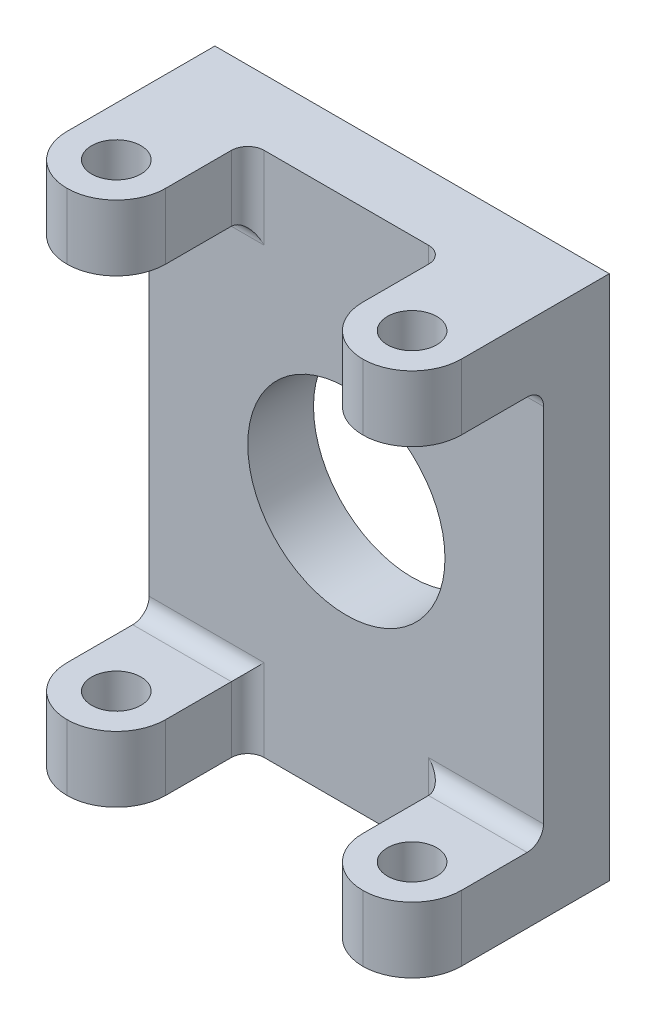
SolidWorks part; units mm, degrees
ref_plane "Front Plane" through (0, 0, 0) normal (0, 0, 1) x (1, 0, 0)
ref_plane "Top Plane" through (0, 0, 0) normal (0, 1, 0) x (1, 0, 0)
ref_plane "Right Plane" through (0, 0, 0) normal (1, 0, 0) x (0, 0, -1)
sketch "Sketch2" plane through (0, 0, 0) normal (0, 0, 1) x (1, 0, 0)
  line L0 (0, 0) -> (137.829, 0) construction
  line L1 (0, 0) -> (0, 93.6852) construction
  line L3 (-76.2, -101.6) -> (76.2, -101.6)
  line L4 (-76.2, -101.6) -> (-76.2, 101.6)
  line L5 (-76.2, 101.6) -> (76.2, 101.6)
  line L6 (76.2, -101.6) -> (76.2, 101.6)
  dimension "D1" = 152.4
  dimension "D2" = 203.2
  dimension "D3" = 76.2
  dimension "D4" = 101.6
extrude "Extrude2" add sketch "Sketch2" along normal blind 25.4
sketch "Sketch3" plane through (0, 0, 25.4) normal (0, 0, 1) x (1, 0, 0)
  line L1 (-76.2, -101.6) -> (-38.1, -101.6)
  line L2 (-76.2, -101.6) -> (-76.2, -76.2)
  line L3 (-76.2, -76.2) -> (-38.1, -76.2)
  line L4 (-38.1, -101.6) -> (-38.1, -76.2)
  dimension "D1" = 38.1
  dimension "D2" = 25.4
extrude "Extrude3" add sketch "Sketch3" along normal blind 50.8
fillet "Fillet1" radius 19.05 2 edges at (-38.1, -88.9, 76.2) (-76.2, -88.9, 76.2)
sketch "Sketch4" plane through (0, -101.6, 0) normal (0, -1, 0) x (1, 0, 0)
  circle A0 centre (-57.15, 57.15) radius 9.525
  arc A1 (-57.15, 76.2) -> (-76.2, 57.15) centre (-57.15, 57.15) ccw construction
  dimension "D1" = 19.05
extrude "Cut-Extrude1" cut sketch "Sketch4" against normal through all
mirror "Mirror1" about plane through (0, 0, 0) normal (1, 0, 0) of "Cut-Extrude1", "Fillet1", "Extrude3"
mirror "Mirror2" about plane through (0, 0, 0) normal (0, 1, 0) of "Mirror1", "Cut-Extrude1", "Fillet1", "Extrude3"
fillet "Fillet2" radius 6.35 8 edges at (38.1, -88.9, 25.4) (38.1, 88.9, 25.4) (-38.1, 88.9, 25.4) (57.15, -76.2, 25.4) (-57.15, 76.2, 25.4) (57.15, 76.2, 25.4)
sketch "Sketch6" plane through (0, 0, 0) normal (0, 0, -1) x (-1, 0, 0)
  circle A0 centre (0, 0) radius 38.1
  dimension "D1" = 76.2
extrude "Cut-Extrude2" cut sketch "Sketch6" against normal through all
equation "\"D3@Sketch2\" = \"D1@Sketch2\"/2"
